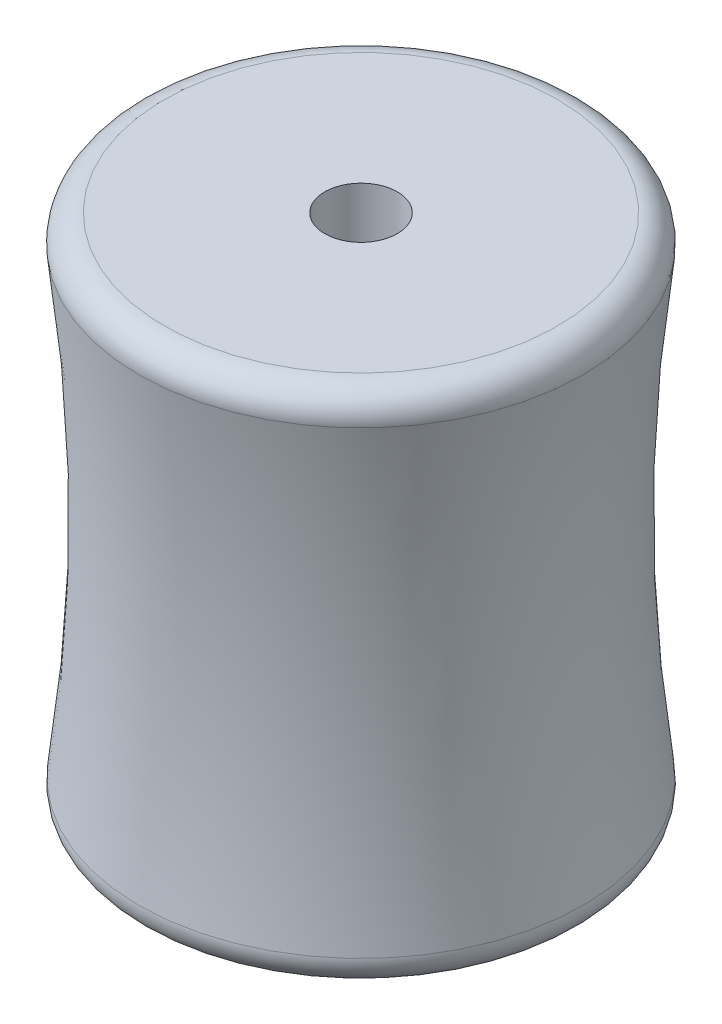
SolidWorks part; units mm, degrees
ref_plane "Front Plane" through (0, 0, 0) normal (0, 0, 1) x (1, 0, 0)
ref_plane "Top Plane" through (0, 0, 0) normal (0, 1, 0) x (1, 0, 0)
ref_plane "Right Plane" through (0, 0, 0) normal (1, 0, 0) x (0, 0, -1)
sketch "Sketch3" plane through (0, 0, 0) normal (1, 0, 0) x (0, 0, -1)
  line L0 (-4, 0) -> (18, 0)
  line L1 (18, 0) -> (18, 60) construction
  line L2 (18, 60) -> (-4, 60)
  line L8 (-8.2, 60) -> (-8.2, 4) construction
  line L11 (-4, 60) -> (-4, 0)
  arc A0 (18, 0) -> (18, 60) centre (215.7372, 30) cw
  point P0 (0.2494, 60)
  dimension "D2" = 200
  dimension "D1" = 4.2
  dimension "30" = 60
  dimension "D3" = 22
revolve "Revolve1" add sketch "Sketch3" angle 360 about L8
fillet "Fillet1" radius 3 2 edges at (0, 60, 34.4) (0, 0, 34.4)
